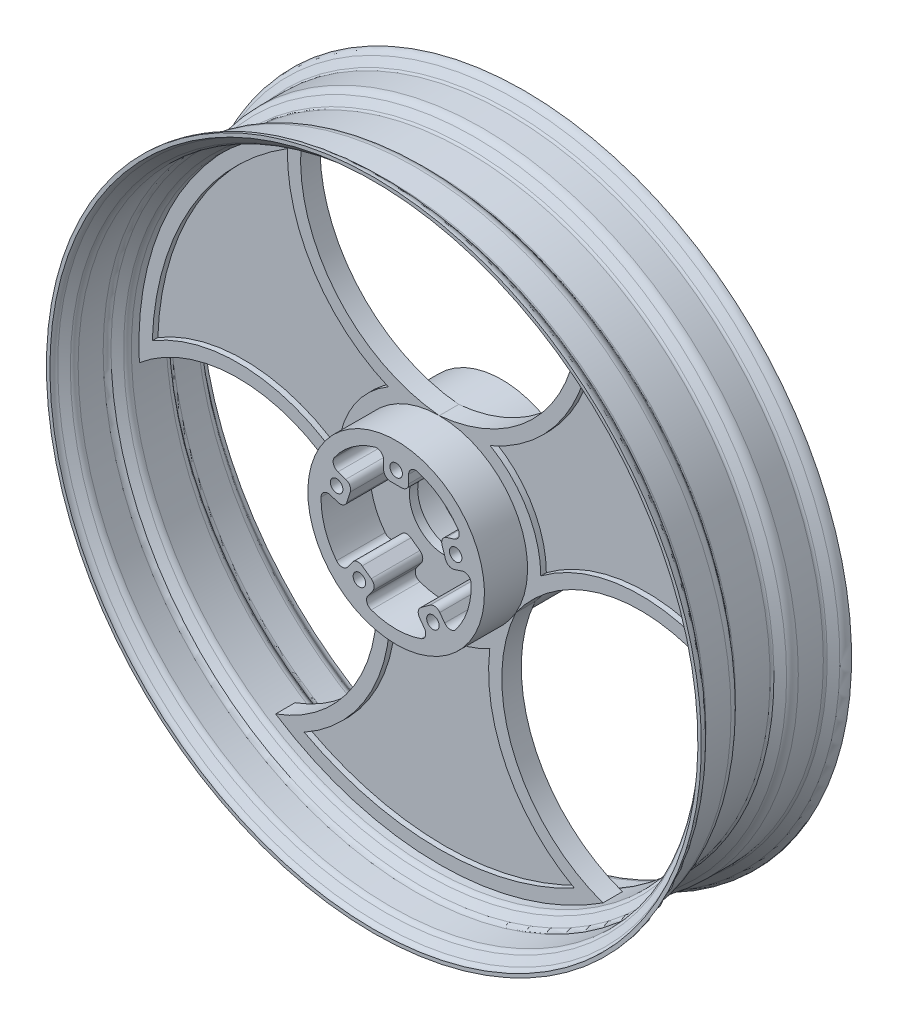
SolidWorks part; units mm, degrees
ref_plane "Front Plane" through (0, 0, 0) normal (0, 0, 1) x (1, 0, 0)
ref_plane "Top Plane" through (0, 0, 0) normal (0, 1, 0) x (1, 0, 0)
ref_plane "Right Plane" through (0, 0, 0) normal (1, 0, 0) x (0, 0, -1)
sketch "Sketch1" plane through (0, 0, 0) normal (1, 0, 0) x (0, 0, -1)
  line L1 (-50.9127, 0) -> (50.9127, 0) construction
  line L2 (-38, 0) -> (38, 0)
  line L3 (38, 0) -> (38, 63.5)
  line L4 (-38, 0) -> (-38, 63.5)
  line L5 (38, 63.5) -> (7, 63.5)
  line L6 (-38, 63.5) -> (-7, 63.5)
  line L7 (7, 63.5) -> (7, 216)
  line L8 (-7, 63.5) -> (-7, 216)
  line L9 (7, 216) -> (12.4092, 216)
  line L10 (16.2394, 217.7861) -> (20.3744, 222.7139)
  line L11 (24.2046, 224.5) -> (42.2046, 224.5)
  line L12 (46.0348, 226.2861) -> (50.1698, 231.2139)
  line L13 (54, 233) -> (54, 235.5)
  line L14 (0, -10.2008) -> (0, 229.5) construction
  line L15 (-12.4092, 218.5) -> (12.4092, 218.5)
  line L16 (14.3243, 219.393) -> (18.4592, 224.3209)
  line L17 (24.2046, 227) -> (42.2046, 227)
  line L18 (44.1197, 227.893) -> (48.2547, 232.8209)
  line L19 (-7, 216) -> (-12.4092, 216)
  line L20 (-44.1197, 227.893) -> (-48.2547, 232.8209)
  line L21 (-24.2046, 227) -> (-42.2046, 227)
  line L22 (-14.3243, 219.393) -> (-18.4592, 224.3209)
  line L23 (-54, 233) -> (-54, 235.5)
  line L24 (-46.0348, 226.2861) -> (-50.1698, 231.2139)
  line L25 (-24.2046, 224.5) -> (-42.2046, 224.5)
  line L26 (-16.2394, 217.7861) -> (-20.3744, 222.7139)
  line L27 (7, 218.5) -> (12.4092, 218.5) construction
  arc A0 (12.4092, 216) -> (16.2394, 217.7861) centre (12.4092, 221) ccw
  arc A1 (20.3744, 222.7139) -> (24.2046, 224.5) centre (24.2046, 219.5) cw
  arc A2 (42.2046, 224.5) -> (46.0348, 226.2861) centre (42.2046, 229.5) ccw
  arc A3 (50.1698, 231.2139) -> (54, 233) centre (54, 228) cw
  arc A4 (12.4092, 218.5) -> (14.3243, 219.393) centre (12.4092, 221) ccw
  arc A5 (18.4592, 224.3209) -> (24.2046, 227) centre (24.2046, 219.5) cw
  arc A6 (42.2046, 227) -> (44.1197, 227.893) centre (42.2046, 229.5) ccw
  arc A7 (48.2547, 232.8209) -> (54, 235.5) centre (54, 228) cw
  arc A8 (-48.2547, 232.8209) -> (-54, 235.5) centre (-54, 228) ccw
  arc A9 (-42.2046, 227) -> (-44.1197, 227.893) centre (-42.2046, 229.5) cw
  arc A10 (-18.4592, 224.3209) -> (-24.2046, 227) centre (-24.2046, 219.5) ccw
  arc A11 (-12.4092, 218.5) -> (-14.3243, 219.393) centre (-12.4092, 221) cw
  arc A12 (-50.1698, 231.2139) -> (-54, 233) centre (-54, 228) ccw
  arc A13 (-42.2046, 224.5) -> (-46.0348, 226.2861) centre (-42.2046, 229.5) cw
  arc A14 (-20.3744, 222.7139) -> (-24.2046, 224.5) centre (-24.2046, 219.5) ccw
  arc A15 (-12.4092, 216) -> (-16.2394, 217.7861) centre (-12.4092, 221) cw
  point P9 (0, 0)
  dimension "D3" = 5
  dimension "D2" = 8.5
  dimension "D4" = 8.5
  dimension "D5" = 108
  dimension "D6" = 2.5
  dimension "D7" = 18
  dimension "D8" = 14
  dimension "D9" = 127
  dimension "D10" = 76
  dimension "D11" = 432
  dimension "D12" = 50
  dimension "D13" = 50
  dimension "D14" = 152.5
  dimension "D15" = 63.5
revolve "Revolve1" add sketch "Sketch1" angle 360 about L1
sketch "Sketch2" plane through (0, 0, 7) normal (0, 0, 1) x (1, 0, 0)
  line L0 (0, 0) -> (0, 254.0596) construction
  arc A0 (0, 63.5) -> (98, 192.489) centre (-10.2634, 173.0201) ccw
  arc A1 (0, 63.5) -> (-98, 192.489) centre (10.2634, 173.0201) cw
  circle A2 centre (0, 0) radius 216 construction
  circle A7 centre (0, 0) radius 63.5 construction
  arc A11 (-98, 192.489) -> (98, 192.489) centre (0, 0) cw
  dimension "D1" = 110
  dimension "D2" = 196
extrude "Cut-Extrude1" cut sketch "Sketch2" against normal up to next
pattern_circular "CirPattern4" count 3 over 360 about axis through (0, 0, 0) along (0, 0, 1) of "Cut-Extrude1"
sketch "Sketch4" plane through (0, 0, 7) normal (0, 0, 1) x (1, 0, 0)
  line L1 (0, 0) -> (0, 259.2316) construction
  arc A4 (-72.9997, 0.1953) -> (-206.3828, 6.9563) centre (-144.7081, -95.3984) ccw
  arc A5 (-72.9997, 0.1953) -> (-206.3828, 6.9563) centre (-144.7081, -95.3984) ccw
  arc A8 (-109.2157, 175.2546) -> (-206.3828, 6.9563) centre (0, 0) ccw
  arc A10 (-36.669, 63.122) -> (-72.9997, 0.1953) centre (0, 0) ccw
  arc A11 (-109.2157, 175.2546) -> (-36.669, 63.122) centre (10.2634, 173.0201) ccw
  arc A12 (-109.2157, 175.2546) -> (-206.3828, 6.9563) centre (0, 0) ccw
  arc A14 (-36.669, 63.122) -> (-72.9997, 0.1953) centre (0, 0) ccw
  arc A15 (-109.2157, 175.2546) -> (-36.669, 63.122) centre (10.2634, 173.0201) ccw
  dimension "D1" = 9.5
extrude "Cut-Extrude2" cut sketch "Sketch4" against normal blind 4
pattern_circular "CirPattern2" count 3 over 360 about axis through (0, 0, 0) along (0, 0, 1) of "Cut-Extrude2"
mirror "Mirror1" about plane through (0, 0, 0) normal (0, 0, 1) of "CirPattern2", "Cut-Extrude2"
sketch "Sketch5" plane through (0, 0, 38) normal (0, 0, 1) x (1, 0, 0)
  circle A0 centre (0, 0) radius 54
  dimension "D1" = 54
extrude "Cut-Extrude3" cut sketch "Sketch5" against normal blind 35
mirror "Mirror4" about plane through (0, 0, 0) normal (0, 0, 1) of "Cut-Extrude3"
sketch "Sketch7" plane through (0, 0, 3) normal (0, 0, 1) x (1, 0, 0)
  circle A0 centre (0, 0) radius 25.5
  dimension "D1" = 51
extrude "Cut-Extrude4" cut sketch "Sketch7" against normal up to next
sketch "Sketch8" plane through (0, 0, 38) normal (0, 0, 1) x (1, 0, 0)
  line L0 (0, 0) -> (0, 76.2199) construction
  line L3 (-9, 53.2447) -> (-9, 36)
  line L4 (-9, 36) -> (9, 36)
  line L5 (9, 53.2447) -> (9, 36)
  circle A0 centre (0, 0) radius 54 construction
  arc A1 (9, 53.2447) -> (-9, 53.2447) centre (0, 0) ccw
  dimension "D1" = 18
  dimension "D2" = 36
extrude "Boss-Extrude2" add sketch "Sketch8" against normal up to next
sketch "Sketch9" plane through (0, 0, 38) normal (0, 0, 1) x (1, 0, 0)
  circle A0 centre (0, 45) radius 4.5
  dimension "D1" = 9
  dimension "D2" = 45
extrude "Cut-Extrude5" cut sketch "Sketch9" against normal blind 25
pattern_circular "CirPattern3" count 5 over 360 about axis through (0, 0, 0) along (0, 0, 1) of "Boss-Extrude2", "Cut-Extrude5"
fillet "Fillet1" radius 5 20 edges at (-38.5776, -37.7858, 20.5) (-28.4414, -23.8345, 20.5) (-24.0153, -48.3659, 20.5) (-13.8791, -34.4147, 20.5) (24.0153, -48.3659, 20.5) (13.8791, -34.4147, 20.5) (38.5776, -37.7858, 20.5) (28.4414, -23.8345, 20.5) (47.8576, 25.013, 20.5) (53.4199, 7.894, 20.5) (31.4569, 19.6841, 20.5) (37.0192, 2.5651, 20.5) (-9, 53.2447, 20.5) (9, 53.2447, 20.5) (9, 36, 20.5) (-9, 36, 20.5) (-53.4199, 7.894, 20.5) (-47.8576, 25.013, 20.5) (-31.4569, 19.6841, 20.5) (-37.0192, 2.5651, 20.5)
